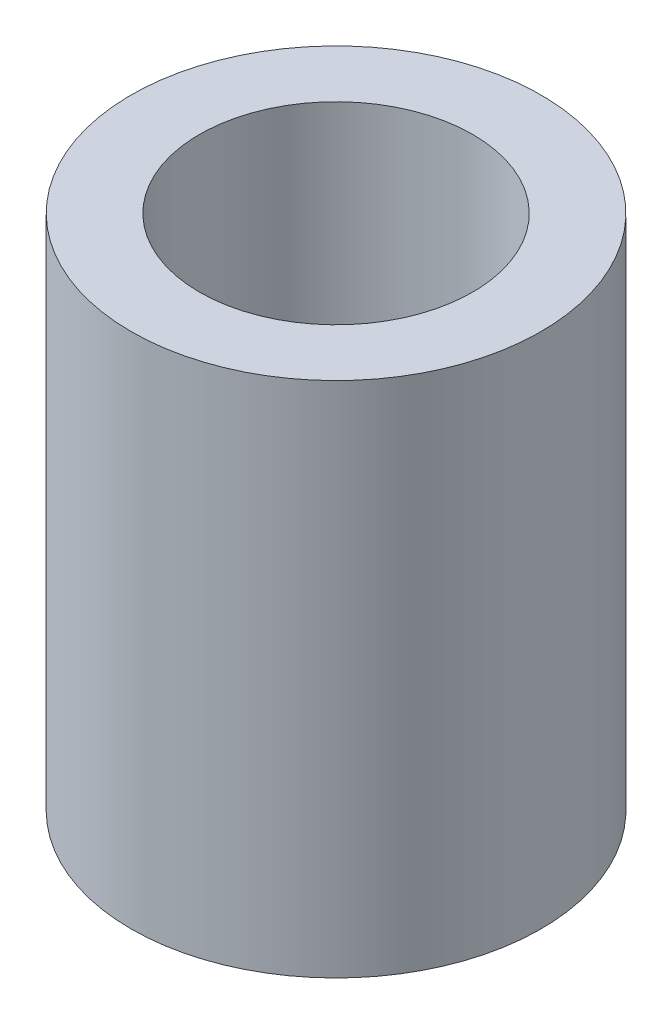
SolidWorks part; units mm, degrees
ref_plane "Face" through (0, 0, 0) normal (0, 0, 1) x (1, 0, 0)
ref_plane "Dessus" through (0, 0, 0) normal (0, 1, 0) x (1, 0, 0)
ref_plane "Droite" through (0, 0, 0) normal (1, 0, 0) x (0, 0, -1)
sketch "Esquisse1" plane through (0, 0, 0) normal (0, 1, 0) x (1, 0, 0)
  circle A0 centre (0, 0) radius 45
  circle A1 centre (0, 0) radius 30
  dimension "D1" = 90
  dimension "D2" = 60
extrude "Base-Extrusion" add sketch "Esquisse1" along normal blind 54.6 and the other way blind 59
ref_plane "Plan1" through (0, -10, 0) normal (0, 1, 0) x (-1, 0, 0)
